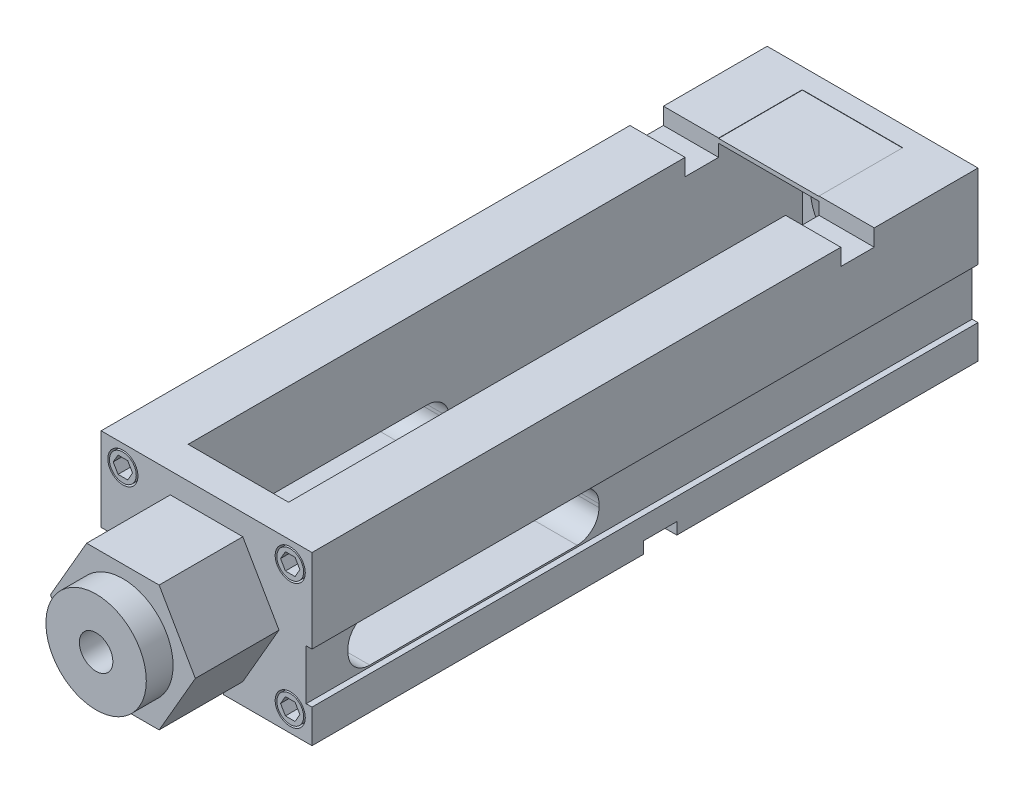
SolidWorks part; units mm, degrees
ref_plane "Vorne" through (0, 0, 0) normal (0, 0, 1) x (1, 0, 0)
ref_plane "Oben" through (0, 0, 0) normal (0, 1, 0) x (1, 0, 0)
ref_plane "Rechts" through (0, 0, 0) normal (1, 0, 0) x (0, 0, -1)
sketch "Skizze1" plane through (2.0485, 3.5659, 0) normal (0, 0, 1) x (1, 0, 0)
  line L1 (0, 0) -> (126, 0)
  line L2 (0, 0) -> (0, 100)
  line L3 (0, 100) -> (126, 100)
  line L4 (126, 0) -> (126, 100)
  dimension "D1" = 126
  dimension "D2" = 100
extrude "Basis-Linear austragen" add sketch "Skizze1" against normal blind 398
sketch "Skizze2" plane through (0, 0, 0) normal (0, 0, 1) x (1, 0, 0)
  line L0 (65.0485, 111.0569) -> (65.0485, -13.6649) construction
  line L2 (2.0485, 103.5659) -> (2.0485, 3.5659) construction
  line L3 (128.0485, 3.5659) -> (128.0485, 103.5659) construction
  line L4 (55.0485, 3.5659) -> (55.0485, 11.0659)
  line L5 (2.0485, 3.5659) -> (128.0485, 3.5659) construction
  line L6 (55.0485, 11.0659) -> (75.0485, 11.0659)
  line L7 (75.0485, 11.0659) -> (75.0485, 3.5659)
  line L8 (75.0485, 3.5659) -> (55.0485, 3.5659)
  line L9 (128.0485, 23.5659) -> (124.5485, 23.5659)
  line L10 (2.0485, 53.5659) -> (5.5485, 53.5659)
  line L11 (2.0485, 53.5659) -> (2.0485, 23.5659)
  line L12 (2.0485, 23.5659) -> (5.5485, 23.5659)
  line L13 (5.5485, 53.5659) -> (5.5485, 23.5659)
  line L14 (128.0485, 23.5659) -> (128.0485, 53.5659)
  line L15 (128.0485, 53.5659) -> (124.5485, 53.5659)
  line L16 (124.5485, 23.5659) -> (124.5485, 53.5659)
  dimension "D1" = 20
  dimension "D2" = 7.5
  dimension "D3" = 20
  dimension "D4" = 30
  dimension "D5" = 3.5
  dimension "D6" = 20
  dimension "D7" = 3.5
  dimension "D8" = 30
extrude "Schnitt-Linear austragen1" cut sketch "Skizze2" against normal through all
sketch "Skizze3" plane through (5.5485, 0, 0) normal (-1, 0, 0) x (0, 0, 1)
  line L0 (-398, 3.5659) -> (0, 3.5659) construction
  line L1 (-175, 52.5659) -> (-25, 52.5659)
  line L2 (-175, 52.5659) -> (-175, 24.5659)
  line L3 (-175, 24.5659) -> (-25, 24.5659)
  line L4 (-25, 52.5659) -> (-25, 24.5659)
  line L5 (0, 23.5659) -> (0, 53.5659) construction
  dimension "D1" = 21
  dimension "D2" = 28
  dimension "D3" = 150
  dimension "D4" = 25
extrude "Schnitt-Linear austragen2" cut sketch "Skizze3" against normal through all
fillet "Verrundung4" radius 13 4 edges at (65.0485, 24.5659, -175) (65.0485, 52.5659, -175) (65.0485, 52.5659, -25) (65.0485, 24.5659, -25)
sketch "Skizze4" plane through (2.0485, 3.5659, 0) normal (-1, 0, 0) x (0, 0, 1)
  line L0 (-398, 0) -> (0, 0) construction
  line L1 (-198, 0) -> (-218, 0)
  line L2 (-198, 0) -> (-198, 7)
  line L3 (-198, 7) -> (-218, 7)
  line L4 (-218, 0) -> (-218, 7)
  line L5 (-398, 100) -> (0, 100) construction
  line L6 (-336, 100) -> (-316, 100)
  line L7 (-336, 100) -> (-336, 90)
  line L8 (-336, 90) -> (-316, 90)
  line L9 (-316, 100) -> (-316, 90)
  line L12 (-398, 20) -> (-398, 0) construction
  dimension "D1" = 20
  dimension "D2" = 180
  dimension "D3" = 7
  dimension "D4" = 118
  dimension "D5" = 20
  dimension "D6" = 10
extrude "Schnitt-Linear austragen3" cut sketch "Skizze4" against normal through all
ref_plane "Ebene1" through (0, 0, -19) normal (0, 0, 1) x (1, 0, 0)
sketch "Skizze5" plane through (0, 0, -19) normal (0, 0, 1) x (1, 0, 0)
  line L0 (65.0485, -16.2341) -> (65.0485, 108.0576) construction
  line L1 (2.0485, 23.5659) -> (2.0485, 3.5659) construction
  line L2 (128.0485, 3.5659) -> (128.0485, 23.5659) construction
  line L3 (128.0485, 103.5659) -> (2.0485, 103.5659) construction
  line L4 (35.0485, 103.5659) -> (95.0485, 103.5659)
  line L5 (35.0485, 103.5659) -> (35.0485, 23.5659)
  line L6 (35.0485, 23.5659) -> (95.0485, 23.5659)
  line L7 (95.0485, 103.5659) -> (95.0485, 23.5659)
  dimension "D1" = 60
  dimension "D2" = 80
extrude "Schnitt-Linear austragen4" cut sketch "Skizze5" against normal blind 367
sketch "Skizze11" plane through (0, 0, 0) normal (0, 0, 1) x (1, 0, 0)
  line L0 (128.0485, 53.5659) -> (128.0485, 103.5659) construction
  line L1 (131.2864, 53.5659) -> (-17.7442, 53.5659) construction
  line L4 (128.0485, 103.5659) -> (2.0485, 103.5659) construction
  line L5 (2.0485, 3.5659) -> (55.0485, 3.5659) construction
  line L7 (21.7472, 53.5659) -> (43.3978, 16.0659)
  line L8 (43.3978, 16.0659) -> (86.6991, 16.0659)
  line L9 (86.6991, 16.0659) -> (108.3497, 53.5659)
  line L10 (108.3497, 53.5659) -> (86.6991, 91.0659)
  line L11 (86.6991, 91.0659) -> (43.3978, 91.0659)
  line L12 (43.3978, 91.0659) -> (21.7472, 53.5659)
  line L13 (75.0485, 3.5659) -> (128.0485, 3.5659) construction
  circle A0 centre (65.0485, 53.5659) radius 37.5 construction
  dimension "D1" = 75
  dimension "D2" = 50
  dimension "D3" = 63
extrude "Aufsatz-Linear austragen1" add sketch "Skizze11" along normal blind 50
sketch "Skizze12" plane through (0, 0, 50) normal (0, 0, 1) x (1, 0, 0)
  circle A0 centre (65.0485, 53.5659) radius 30
  dimension "D1" = 60
extrude "Aufsatz-Linear austragen2" add sketch "Skizze12" along normal blind 16
sketch "Skizze15" plane through (0, 0, -398) normal (0, 0, -1) x (-1, 0, 0)
  line L0 (-65.0485, -11.7578) -> (-65.0485, 116.092) construction
  line L4 (-128.0485, 53.5659) -> (-128.0485, 103.5659) construction
  line L5 (-2.0485, 103.5659) -> (-2.0485, 53.5659) construction
  line L6 (-128.0485, 103.5659) -> (-2.0485, 103.5659) construction
  line L7 (-2.0485, 3.5659) -> (-55.0485, 3.5659) construction
  line L8 (4.0687, 53.5659) -> (-132.9517, 53.5659) construction
  circle A4 centre (-115.0485, 91.0659) radius 8
  circle A5 centre (-15.0485, 91.0659) radius 8
  circle A6 centre (-15.0485, 16.0659) radius 9
  circle A7 centre (-115.0485, 16.0659) radius 8
  circle A8 centre (-15.0485, 91.0659) radius 9
  circle A9 centre (-115.0485, 91.0659) radius 9
  circle A10 centre (-15.0485, 16.0659) radius 8
  circle A11 centre (-115.0485, 16.0659) radius 9
  dimension "D11" = 16
  dimension "D12" = 16
  dimension "D13" = 16
  dimension "D14" = 16
  dimension "D5" = 100
  dimension "D6" = 75
  dimension "D1" = 1
  dimension "D2" = 1
  dimension "D3" = 1
  dimension "D4" = 1
extrude "Schnitt-Linear austragen7" cut sketch "Skizze15" against normal blind 12
sketch "Skizze16" plane through (0, 0, -398) normal (0, 0, -1) x (-1, 0, 0)
  line L1 (-2.0485, 3.5659) -> (-55.0485, 3.5659) construction
  line L2 (10.1418, 53.5659) -> (-167.9736, 53.5659) construction
  line L3 (-65.0485, -23.5293) -> (-65.0485, 124.6532) construction
  line L4 (-2.0485, 103.5659) -> (-2.0485, 53.5659) construction
  line L5 (-128.0485, 53.5659) -> (-128.0485, 103.5659) construction
  line L6 (-75.0485, 3.5659) -> (-128.0485, 3.5659) construction
  line L7 (-109.275, 91.0659) -> (-112.1617, 96.0659)
  line L8 (-112.1617, 96.0659) -> (-117.9352, 96.0659)
  line L9 (-117.9352, 96.0659) -> (-120.822, 91.0659)
  line L10 (-120.822, 91.0659) -> (-117.9352, 86.0659)
  line L11 (-117.9352, 86.0659) -> (-112.1617, 86.0659)
  line L12 (-112.1617, 86.0659) -> (-109.275, 91.0659)
  line L13 (-12.1617, 86.0659) -> (-9.275, 91.0659)
  line L14 (-9.275, 91.0659) -> (-12.1617, 96.0659)
  line L15 (-12.1617, 96.0659) -> (-17.9352, 96.0659)
  line L16 (-17.9352, 96.0659) -> (-20.822, 91.0659)
  line L17 (-128.0485, 103.5659) -> (-2.0485, 103.5659) construction
  line L18 (-20.822, 91.0659) -> (-17.9352, 86.0659)
  line L19 (-12.1617, 11.0659) -> (-9.275, 16.0659)
  line L20 (-17.9352, 86.0659) -> (-12.1617, 86.0659)
  line L21 (-9.275, 16.0659) -> (-12.1617, 21.0659)
  line L22 (-12.1617, 21.0659) -> (-17.9352, 21.0659)
  line L23 (-17.9352, 21.0659) -> (-20.822, 16.0659)
  line L24 (-20.822, 16.0659) -> (-17.9352, 11.0659)
  line L25 (-109.275, 16.0659) -> (-112.1617, 21.0659)
  line L26 (-112.1617, 21.0659) -> (-117.9352, 21.0659)
  line L27 (-117.9352, 21.0659) -> (-120.822, 16.0659)
  line L28 (-120.822, 16.0659) -> (-117.9352, 11.0659)
  line L29 (-117.9352, 11.0659) -> (-112.1617, 11.0659)
  line L30 (-112.1617, 11.0659) -> (-109.275, 16.0659)
  line L32 (-17.9352, 11.0659) -> (-12.1617, 11.0659)
  circle A0 centre (-115.0485, 91.0659) radius 5 construction
  circle A1 centre (-15.0485, 91.0659) radius 5 construction
  circle A3 centre (-15.0485, 16.0659) radius 5 construction
  circle A4 centre (-115.0485, 16.0659) radius 5 construction
  dimension "D1" = 10
  dimension "D2" = 10
  dimension "D3" = 10
  dimension "D4" = 10
  dimension "D5" = 100
  dimension "D6" = 75
extrude "Schnitt-Linear austragen8" cut sketch "Skizze16" against normal blind 7
sketch "Skizze17" plane through (0, 0, 0) normal (0, 0, 1) x (1, 0, 0)
  line L0 (65.0485, 114.9255) -> (65.0485, -23.0139) construction
  line L1 (151.4497, 53.5659) -> (-21.9643, 53.5659) construction
  line L2 (75.0485, 3.5659) -> (128.0485, 3.5659) construction
  line L3 (128.0485, 103.5659) -> (2.0485, 103.5659) construction
  line L4 (2.0485, 23.5659) -> (2.0485, 3.5659) construction
  line L5 (128.0485, 3.5659) -> (128.0485, 23.5659) construction
  circle A0 centre (15.0485, 91.0659) radius 8
  circle A1 centre (115.0485, 91.0659) radius 8
  circle A2 centre (115.0485, 16.0659) radius 8
  circle A3 centre (15.0485, 16.0659) radius 8
  circle A4 centre (115.0485, 16.0659) radius 9
  circle A5 centre (115.0485, 91.0659) radius 9
  circle A6 centre (15.0485, 91.0659) radius 9
  circle A7 centre (15.0485, 16.0659) radius 9
  dimension "D1" = 16
  dimension "D2" = 16
  dimension "D3" = 16
  dimension "D4" = 16
  dimension "D5" = 1
  dimension "D7" = 100
  dimension "D8" = 75
  dimension "D6" = 1
extrude "Schnitt-Linear austragen9" cut sketch "Skizze17" against normal blind 12
sketch "Skizze18" plane through (0, 0, 0) normal (0, 0, 1) x (1, 0, 0)
  line L0 (65.0485, 110.3922) -> (65.0485, -18.6172) construction
  line L1 (-5.2826, 53.5659) -> (144.3645, 53.5659) construction
  line L2 (2.0485, 3.5659) -> (55.0485, 3.5659) construction
  line L3 (128.0485, 103.5659) -> (2.0485, 103.5659) construction
  line L4 (2.0485, 103.5659) -> (2.0485, 53.5659) construction
  line L5 (128.0485, 53.5659) -> (128.0485, 103.5659) construction
  line L6 (75.0485, 3.5659) -> (128.0485, 3.5659) construction
  line L7 (17.9352, 86.0659) -> (20.822, 91.0659)
  line L8 (20.822, 91.0659) -> (17.9352, 96.0659)
  line L9 (17.9352, 96.0659) -> (12.1617, 96.0659)
  line L10 (12.1617, 96.0659) -> (9.275, 91.0659)
  line L11 (9.275, 91.0659) -> (12.1617, 86.0659)
  line L12 (12.1617, 86.0659) -> (17.9352, 86.0659)
  line L13 (117.9352, 86.0659) -> (120.822, 91.0659)
  line L14 (120.822, 91.0659) -> (117.9352, 96.0659)
  line L15 (117.9352, 96.0659) -> (112.1617, 96.0659)
  line L16 (112.1617, 96.0659) -> (109.275, 91.0659)
  line L17 (109.275, 91.0659) -> (112.1617, 86.0659)
  line L18 (112.1617, 86.0659) -> (117.9352, 86.0659)
  line L19 (117.9352, 11.0659) -> (120.822, 16.0659)
  line L20 (120.822, 16.0659) -> (117.9352, 21.0659)
  line L21 (117.9352, 21.0659) -> (112.1617, 21.0659)
  line L22 (112.1617, 21.0659) -> (109.275, 16.0659)
  line L23 (109.275, 16.0659) -> (112.1617, 11.0659)
  line L24 (112.1617, 11.0659) -> (117.9352, 11.0659)
  line L25 (17.9352, 11.0659) -> (20.822, 16.0659)
  line L26 (20.822, 16.0659) -> (17.9352, 21.0659)
  line L27 (17.9352, 21.0659) -> (12.1617, 21.0659)
  line L28 (12.1617, 21.0659) -> (9.275, 16.0659)
  line L29 (9.275, 16.0659) -> (12.1617, 11.0659)
  line L30 (12.1617, 11.0659) -> (17.9352, 11.0659)
  circle A0 centre (15.0485, 91.0659) radius 5 construction
  circle A1 centre (115.0485, 91.0659) radius 5 construction
  circle A2 centre (115.0485, 16.0659) radius 5 construction
  circle A3 centre (15.0485, 16.0659) radius 5 construction
  dimension "D1" = 10
  dimension "D2" = 10
  dimension "D3" = 75
  dimension "D4" = 100
extrude "Schnitt-Linear austragen10" cut sketch "Skizze18" against normal blind 10
sketch "Skizze21" plane through (0, 0, -19) normal (0, 0, -1) x (-1, 0, 0)
  line L0 (-65.0485, 110.0887) -> (-65.0485, 3.46) construction
  line L1 (-128.0485, 53.5659) -> (-128.0485, 103.5659) construction
  line L2 (-2.0485, 103.5659) -> (-2.0485, 53.5659) construction
  line L3 (-128.0485, 103.5659) -> (-2.0485, 103.5659) construction
  circle A0 centre (-65.0485, 53.5659) radius 20
  dimension "D1" = 40
  dimension "D2" = 50
extrude "Schnitt-Linear austragen11" cut sketch "Skizze21" against normal blind 25
sketch "Skizze22" plane through (0, 0, -386) normal (0, 0, 1) x (1, 0, 0)
  line L0 (65.0485, 116.1582) -> (65.0485, 12.7829) construction
  line L1 (128.0485, 53.5659) -> (128.0485, 103.5659) construction
  line L2 (2.0485, 103.5659) -> (2.0485, 53.5659) construction
  line L5 (128.0485, 103.5659) -> (2.0485, 103.5659) construction
  circle A0 centre (65.0485, 53.5659) radius 25
  dimension "D1" = 50
  dimension "D2" = 50
extrude "Schnitt-Linear austragen12" cut sketch "Skizze22" against normal blind 5
sketch "Skizze24" plane through (0, 0, 66) normal (0, 0, 1) x (1, 0, 0)
  line L0 (128.0485, 103.5659) -> (2.0485, 103.5659) construction
  line L3 (2.0485, 103.5659) -> (2.0485, 53.5659) construction
  circle A3 centre (65.0485, 53.5659) radius 10
  dimension "D1" = 20
  dimension "D2" = 50
  dimension "D3" = 63
extrude "Schnitt-Linear austragen13" cut sketch "Skizze24" against normal blind 73
sketch "Skizze26" plane through (0, 0, -386) normal (0, 0, 1) x (1, 0, 0)
  line L0 (35.0485, 103.3659) -> (95.0485, 103.3659)
  line L1 (95.0485, 103.3659) -> (95.0485, 100.8659)
  line L2 (95.0485, 23.5659) -> (95.0485, 103.5659) construction
  line L3 (95.0485, 100.8659) -> (35.0485, 100.8659)
  line L5 (35.0485, 103.3659) -> (35.0485, 100.8659)
  line L6 (95.0485, 103.5659) -> (35.0485, 103.5659) construction
  line L7 (35.0485, 103.5659) -> (35.0485, 23.5659) construction
  dimension "D1" = 0.2
  dimension "D2" = 2.5
extrude "Aufsatz-Linear austragen3" add sketch "Skizze26" along normal up to surface (50 mm away)
